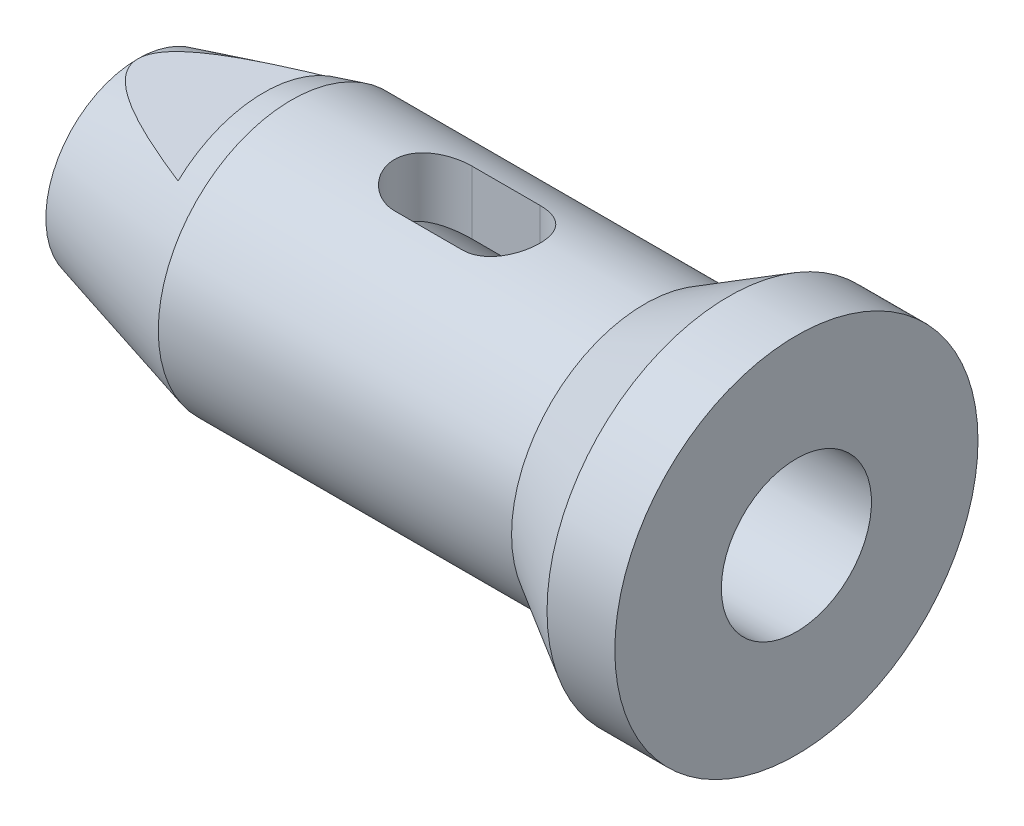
SolidWorks part; units mm, degrees
ref_plane "Plan de face" through (0, 0, 0) normal (0, 0, 1) x (1, 0, 0)
ref_plane "Plan de dessus" through (0, 0, 0) normal (0, 1, 0) x (1, 0, 0)
ref_plane "Plan de droite" through (0, 0, 0) normal (1, 0, 0) x (0, 0, -1)
sketch "Esquisse2" plane through (0, 0, 0) normal (0, 0, 1) x (1, 0, 0)
  line L0 (0, 0) -> (121.8315, 0) construction
  line L1 (0, 0) -> (0, 9.5)
  line L2 (0, 9.5) -> (15.8612, 13.75)
  line L3 (15.8612, 13.75) -> (52.3397, 13.75)
  line L4 (52.3397, 13.75) -> (61, 18.75)
  line L5 (61, 18.75) -> (68, 18.75)
  line L6 (68, 18.75) -> (68, 0)
  line L7 (68, 0) -> (0, 0)
  dimension "D1" = 19
  dimension "D2" = 27.5
  dimension "D3" = 37.5
  dimension "D4" = 68
  dimension "D5" = 7
  dimension "D6" = 15
  dimension "D7" = 30
revolve "Révolution1" add sketch "Esquisse2" angle 360 about L0
sketch "Esquisse7" plane through (0, 0, 0) normal (0, 0, 1) x (1, 0, 0)
  line L0 (0, 9.5) -> (0, -9.5) construction
  line L1 (0, 9.5) -> (13, 9.5)
  line L2 (0, 9.5) -> (0, 16.8638)
  line L3 (0, 16.8638) -> (13, 16.8638)
  line L4 (13, 9.5) -> (13, 16.8638)
  line L7 (0, -9.5) -> (13, -9.5)
  line L8 (0, -9.5) -> (0, -19.6718)
  line L9 (0, -19.6718) -> (13, -19.6718)
  line L10 (13, -9.5) -> (13, -19.6718)
  dimension "D2" = 13
  dimension "D3" = 19
  dimension "D4" = 9.5
  dimension "D5" = 13
extrude "Enlèv. mat.-Extru.5" cut sketch "Esquisse7" against normal through all and the other way through all
sketch "Esquisse9" plane through (0, 0, 0) normal (0, 1, 0) x (1, 0, 0)
  line L1 (68, -18.75) -> (68, 18.75) construction
  line L2 (37.5, 4) -> (30.5, 4)
  line L3 (37.5, -4) -> (30.5, -4)
  line L4 (0, 0) -> (121.8315, 0) construction
  arc A0 (30.5, 4) -> (30.5, -4) centre (30.5, 0) ccw
  arc A1 (37.5, -4) -> (37.5, 4) centre (37.5, 0) ccw
  dimension "D1" = 8
  dimension "D3" = 8
  dimension "D2" = 37.5
  dimension "D4" = 7
extrude "Enlèv. mat.-Extru.6" cut sketch "Esquisse9" against normal through all and the other way through all
sketch "Esquisse10" plane through (0, 0, 0) normal (-1, 0, 0) x (0, 0, 1)
  circle A0 centre (0, 0) radius 7.75
  arc A1 (0, -9.5) -> (0, 9.5) centre (0, 0) ccw construction
  dimension "D1" = 15.5
extrude "Enlèv. mat.-Extru.7" cut sketch "Esquisse10" against normal through all
sketch "Esquisse11" plane through (0, 0, 0) normal (-1, 0, 0) x (0, 0, 1)
  circle A0 centre (0, 0) radius 8
  circle A1 centre (0, 0) radius 7.75 construction
  dimension "D1" = 16
extrude "Enlèv. mat.-Extru.8" cut sketch "Esquisse11" against normal blind 16
chamfer "Chanfrein1" distance 0.5 angle 45 1 edges at (0, 0, 8)
sketch "Esquisse12" plane through (0, 0, 0) normal (-1, 0, 0) x (0, 0, 1)
  arc A0 (0, -9.5) -> (0, 9.5) centre (0, 0) ccw construction
  point P0 (0, 0)
